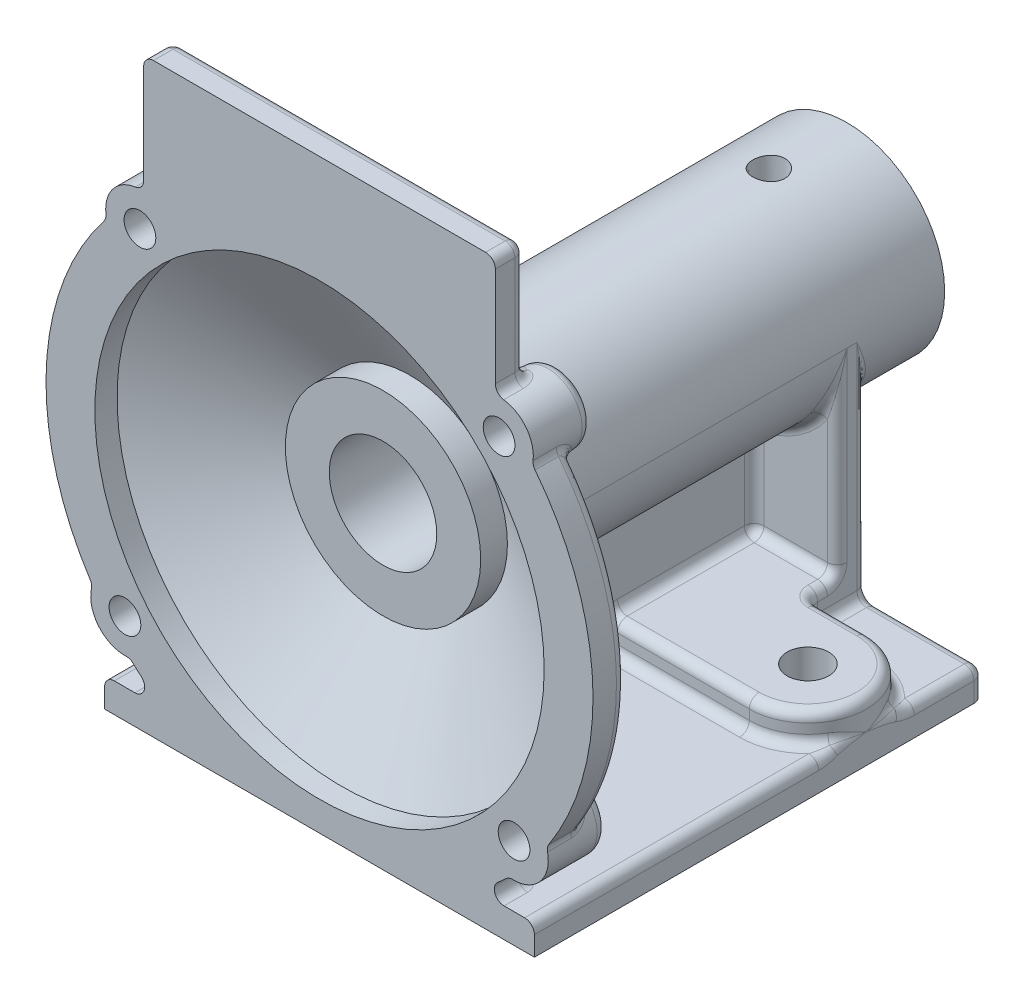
SolidWorks part; units mm, degrees
ref_plane "Front" through (0, 0, 0) normal (0, 0, 1) x (1, 0, 0)
ref_plane "Top" through (0, 0, 0) normal (0, 1, 0) x (1, 0, 0)
ref_plane "Right" through (0, 0, 0) normal (1, 0, 0) x (0, 0, -1)
sketch "Sketch1" plane through (0, 0, 0) normal (1, 0, 0) x (0, 0, -1)
  line L0 (0, 0) -> (89.8884, 0) construction
  line L1 (0, -73.025) -> (0, -88.9)
  line L2 (0, -88.9) -> (9.525, -88.9)
  line L3 (9.525, -88.9) -> (40.1411, -31.75)
  line L4 (40.1411, -31.75) -> (171.45, -31.75)
  line L5 (171.45, -31.75) -> (171.45, -17.4625)
  line L6 (171.45, -17.4625) -> (120.65, -17.4625)
  line L7 (120.65, -17.4625) -> (120.65, -20.6375)
  line L8 (120.65, -20.6375) -> (69.85, -20.6375)
  line L9 (69.85, -20.6375) -> (69.85, -17.4625)
  line L10 (69.85, -17.4625) -> (20.6502, -17.4625)
  line L11 (20.6502, -17.4625) -> (20.6502, -31.75)
  line L12 (20.6502, -31.75) -> (29.3354, -31.75)
  line L13 (29.3354, -31.75) -> (7.2238, -73.025)
  line L14 (7.2238, -73.025) -> (0, -73.025)
  point P5 (57.15, 0)
  dimension "D1" = 34.925
  dimension "D2" = 41.275
  dimension "D3" = 50.8
  dimension "D4" = 50.8
  dimension "D5" = 63.5
  dimension "D6" = 146.05
  dimension "D7" = 177.8
  dimension "D8" = 9.525
  dimension "D9" = 9.525
  dimension "D10" = 20.6502
  dimension "D11" = 171.45
  dimension "D12" = 57.15
revolve "Revolve1" add sketch "Sketch1" angle 360 about L0
sketch "Sketch2" plane through (0, 0, 0) normal (0, 0, 1) x (1, 0, 0)
  line L0 (0, 0) -> (0, 144.1236) construction
  line L1 (-57.15, 68.0962) -> (-26.3735, 68.0962)
  line L2 (-57.15, 68.0962) -> (-57.15, 107.95)
  line L3 (-57.15, 107.95) -> (57.15, 107.95)
  line L4 (57.15, 68.0962) -> (57.15, 107.95)
  line L5 (26.3735, 68.0962) -> (57.15, 68.0962)
  circle A0 centre (0, 0) radius 88.9 construction
  circle A1 centre (0, 0) radius 73.025 construction
  arc A2 (26.3735, 68.0962) -> (-26.3735, 68.0962) centre (0, 0) ccw
  dimension "D1" = 114.3
  dimension "D2" = 107.95
extrude "Extrude1" add sketch "Sketch2" against normal blind 9.525
sketch "Sketch3" plane through (0, 0, 0) normal (0, 0, 1) x (1, 0, 0)
  line L0 (0, 0) -> (105.8426, 0) construction
  line L1 (0, 0) -> (73.9921, 73.9921) construction
  line L2 (49.9927, 65.6904) -> (43.7106, 58.4982)
  line L3 (65.6904, 49.9927) -> (58.4982, 43.7106)
  circle A0 centre (0, 0) radius 82.55 construction
  arc A1 (49.9927, 65.6904) -> (65.6904, 49.9927) centre (58.3717, 58.3717) cw
  circle A2 centre (0, 0) radius 73.025 construction
  circle A3 centre (0, 0) radius 73.025 construction
  arc A4 (58.4982, 43.7106) -> (43.7106, 58.4982) centre (0, 0) ccw
  dimension "D2" = 165.1
  dimension "D3" = 11.1252
  dimension "D1" = 45
extrude "Extrude2" add sketch "Sketch3" against normal blind 19.05
sketch "Sketch4" plane through (0, 0, -19.05) normal (0, 0, -1) x (-1, 0, 0)
  circle A0 centre (-58.3717, 58.3717) radius 5.1562
  dimension "D1" = 10.3124
extrude "Extrude3" cut sketch "Sketch4" against normal through all
pattern_circular "CirPattern1" count 2 every 85 about axis through (0, 0, 0) along (0, 0, 1) of "Extrude2", "Extrude3"
mirror "Mirror1" about plane through (0, 0, 0) normal (1, 0, 0) of "CirPattern1", "Extrude2", "Extrude3"
other "DeleteFace1"
ref_plane "Plane1" through (0, -82.55, 0) normal (0, 1, 0) x (-1, 0, 0)
other "SurfaceCut1"
sketch "Sketch5" plane through (0, -82.55, 0) normal (0, 1, 0) x (-1, 0, 0)
  line L0 (0, -146.05) -> (0, 0) construction
  line L1 (-69.85, 0) -> (69.85, 0)
  line L2 (-69.85, 0) -> (-69.85, -146.05)
  line L3 (-69.85, -146.05) -> (69.85, -146.05)
  line L4 (69.85, 0) -> (69.85, -146.05)
  dimension "D1" = 139.7
  dimension "D2" = 146.05
extrude "Extrude4" add sketch "Sketch5" along normal blind 9.525
sketch "Sketch8" plane through (0, 0, -146.05) normal (0, 0, -1) x (-1, 0, 0)
  line L0 (0, -73.025) -> (0, -31.75)
  line L1 (-69.85, -73.025) -> (69.85, -73.025) construction
  circle A0 centre (0, 0) radius 31.75 construction
rib "Rib2" sketch "Sketch8" sketch "Sketch8" thickness 9.525 extrusion direction normal to sketch draft on no parameters "D1"=9.525
sketch "Sketch9" plane through (0, 0, -146.05) normal (0, 0, -1) x (-1, 0, 0)
  line L0 (-31.75, 0) -> (-31.75, -73.025)
  line L4 (-4.7625, -73.025) -> (-50.7007, -73.025) construction
  line L6 (31.75, 0) -> (31.75, -73.025)
  line L7 (50.7007, -73.025) -> (4.7625, -73.025) construction
  line L8 (-31.75, -73.025) -> (31.75, -73.025)
  arc A4 (4.7625, -31.3908) -> (-4.7625, -31.3908) centre (0, 0) ccw construction
  circle A5 centre (0, 0) radius 31.75 construction
  arc A6 (-31.75, 0) -> (31.75, 0) centre (0, 0) ccw
extrude "Extrude5" add sketch "Sketch9" against normal blind 9.525
sketch "Sketch10" plane through (0, 0, 0) normal (1, 0, 0) x (0, 0, -1)
  line L0 (0, -49.5673) -> (0, -64.1873) construction
  line L1 (0, -82.55) -> (146.05, -82.55) construction
  circle A0 centre (63.5, -53.975) radius 12.7
  dimension "D1" = 25.4
  dimension "D2" = 63.5
  dimension "D3" = 28.575
extrude "Extrude6" cut sketch "Sketch10" against normal through all and the other way through all
sketch "Sketch11" plane through (0, -73.025, 0) normal (0, 1, 0) x (1, 0, 0)
  line L0 (31.75, 146.05) -> (4.7625, 146.05)
  line L1 (31.75, 146.05) -> (-31.75, 146.05) construction
  line L2 (4.7625, 146.05) -> (4.7625, 88.9)
  line L3 (4.7625, 136.525) -> (4.7625, 40.1411) construction
  line L4 (4.7625, 88.9) -> (50.8, 88.9)
  line L5 (50.8, 127) -> (31.75, 127)
  line L6 (31.75, 40.1411) -> (31.75, 136.525) construction
  line L7 (31.75, 127) -> (31.75, 146.05)
  line L8 (69.85, 0) -> (69.85, 146.05) construction
  line L10 (57.15, 0) -> (-57.15, 0) construction
  arc A0 (50.8, 88.9) -> (50.8, 127) centre (50.8, 107.95) ccw
  dimension "D1" = 50.8
  dimension "D2" = 107.95
extrude "Extrude7" add sketch "Sketch11" along normal blind 9.525
sketch "Sketch12" plane through (0, -63.5, 0) normal (0, 1, 0) x (1, 0, 0)
  circle A0 centre (50.8, 107.95) radius 6.7437
  dimension "D1" = 13.4874
extrude "Extrude8" cut sketch "Sketch12" against normal through all
mirror "Mirror2" about plane through (0, 0, 0) normal (1, 0, 0) of "Extrude8", "Extrude7"
ref_plane "Plane2" through (0, 31.75, -105.7955) normal (0, 1, 0) x (-1, 0, 0)
sketch "Sketch13" plane through (0, 31.75, -105.7955) normal (0, 1, 0) x (-1, 0, 0)
  line L0 (0, 44.0417) -> (0, 112.0674) construction
  line L1 (-11.1252, 65.6545) -> (11.1252, 65.6545)
  line L2 (-31.75, 65.6545) -> (31.75, 65.6545) construction
  line L3 (11.1252, 65.6545) -> (11.1252, 61.3455)
  line L4 (-11.1252, 61.3455) -> (-11.1252, 65.6545)
  line L5 (-20.6375, 35.9455) -> (20.6375, 35.9455) construction
  arc A0 (11.1252, 61.3455) -> (-11.1252, 61.3455) centre (0, 61.3455) cw
  dimension "D1" = 11.1252
  dimension "D2" = 25.4
extrude "Extrude9" add sketch "Sketch13" along normal blind 6.35 and the other way up to next
other "DeleteFace2"
hole_wizard "1/8 NPT Tapped Hole1" positions "3DSketch1" profile "Sketch14" size "1/8" standard "Ansi Inch"
sketch3d "3DSketch1"
  arc A0 (11.1252, 38.1, -44.45) -> (-11.1252, 38.1, -44.45) centre (0, 38.1, -44.45) ccw construction
  point P0 (0, 38.1, -44.45)
  point P2 (0, 31.75, -146.05)
  point P9 (0, 49.2252, -44.45)
  dimension "D1" = 25.4
sketch "Sketch14" plane through (0, 38.1, -44.45) normal (1, 0, 0) x (0, 0, 1)
  line L0 (0, 0) -> (0, 20.6375)
  line L1 (0, 20.6375) -> (4.2164, 20.6375)
  line L2 (-4.9362, 9.525) -> (-5.2214, 0) construction
  line L3 (4.2164, 20.6375) -> (4.2164, 9.525)
  line L4 (4.2164, 9.525) -> (4.9362, 9.525)
  line L5 (4.9362, 9.525) -> (5.2214, 0)
  line L7 (5.2214, 0) -> (0, 0)
  line L8 (0, -6.35) -> (0, 107.95) construction
  line L11 (-4.2164, 9.525) -> (-4.9362, 9.525) construction
  dimension "Thru Tap Drill Dia." = 8.4328
  dimension "Thru Tap Drill Depth" = 20.6375
  dimension "Thread Dia." = 10.4428
  dimension "Thread Angle" = 3.43
  dimension "Thread Depth" = 9.525
fillet "Fillet1" radius 3.175 14 edges at (-31.75, -31.75, -136.525) (31.75, -31.75, -136.525) (-31.75, -63.5, -131.7625) (31.75, -63.5, -131.7625) (-27.7812, -63.5, -88.9) (-41.275, -63.5, -127) (27.7812, -63.5, -88.9) (41.275, -63.5, -127) (-18.2562, -63.5, -136.525) (-31.75, -68.2625, -127) (-69.85, -63.5, -107.95) (18.2563, -63.5, -136.525) (31.75, -68.2625, -127) (69.85, -63.5, -107.95)
fillet "Fillet2" radius 3.175 24 edges at (-31.75, -73.025, -138.1125) (-32.6799, -73.025, -127.9299) (-42.8625, -73.025, -127) (-64.2704, -73.025, -121.4204) (-64.2704, -73.025, -94.4796) (-4.7625, -45.8579, -136.525) (-4.7625, -62.5701, -135.5951) (-4.7625, -63.5, -112.7125) (-4.7625, -64.4299, -89.8299) (4.7625, -45.8579, -136.525) (4.7625, -62.5701, -135.5951) (4.7625, -63.5, -112.7125) (4.7625, -64.4299, -89.8299) (31.75, -73.025, -138.1125) (32.6799, -73.025, -127.9299) (42.8625, -73.025, -127) (64.2704, -73.025, -121.4204) (64.2704, -73.025, -94.4796) (-27.7812, -73.025, -88.9) (-4.7625, -69.85, -88.9) (-4.7625, -73.025, -53.4232) (4.7625, -73.025, -53.4232) (4.7625, -69.85, -88.9) (27.7812, -73.025, -88.9)
fillet "Fillet3" radius 3.175 28 edges at (-50.7007, -73.025, -4.7625) (50.7007, -73.025, -4.7625) (31.75, -34.925, -146.05) (32.6799, -72.0951, -146.05) (69.85, -73.025, -48.2512) (69.85, -73.025, -102.2262) (69.85, -73.025, -113.6738) (6.0975, -72.4375, -18.207) (-5.6525, -72.0545, -18.4308) (-31.75, -34.925, -146.05) (-32.6799, -72.0951, -146.05) (-69.85, -73.025, -48.2512) (-69.85, -73.025, -102.2262) (-69.85, -73.025, -113.6738) (69.85, -77.7875, -146.05) (52.3875, -73.025, -146.05) (69.85, -73.025, -132.7238) (56.3432, -68.7652, -9.525) (-56.3432, -68.7652, -9.525) (-69.85, -77.7875, -146.05) (-52.3875, -73.025, -146.05) (-69.85, -73.025, -132.7238) (-4.7625, -41.275, -63.5) (4.7625, -41.275, -63.5)
fillet "Fillet4" radius 3.175 21 edges at (11.1252, 38.1, -40.1685) (-11.1252, 38.1, -40.1685) (-11.1252, 29.7371, -42.2955) (11.1252, 29.7371, -42.2955) (-30.6752, -8.191, -137.3189) (-31.6957, -1.8554, -40.1411) (-5.5714, -31.2574, -41.0895) (-4.7625, -31.3908, -88.3781) (-5.9268, -31.1919, -135.8072) (31.6957, -1.8554, -40.1411) (5.9455, -31.1884, -40.7249) (4.7625, -31.3908, -88.3781) (5.4424, -31.2801, -135.3134) (30.6752, -8.191, -137.3189) (-30.6752, -8.191, -145.2561) (30.6752, -8.191, -145.2561) (0, 38.1, -55.5752) (0.9693, 31.7352, -55.5329) (-20.1175, -24.5632, -136.525) (20.1175, -24.5632, -136.525) (0, -31.75, -146.05)
fillet "Fillet5" radius 3.175 15 edges at (51.3964, -57.1126, -19.05) (65.1698, -40.6981, -19.05) (-51.3964, -57.1126, -19.05) (-65.1698, -40.6981, -19.05) (-61.3748, 46.2232, -19.05) (-46.2232, 61.3748, -19.05) (61.3748, 46.2232, -19.05) (46.2232, 61.3748, -19.05) (71.7594, -60.2133, -19.05) (-71.7594, -60.2133, -19.05) (-66.2384, 66.2384, -19.05) (66.2384, 66.2384, -19.05) (-88.8154, 3.8778, -9.525) (0, 88.9, -9.525) (88.8154, 3.8778, -9.525)
fillet "Fillet6" radius 3.175 48 edges at (-57.15, 69.4296, -4.7625) (57.15, 69.4296, -4.7625) (-61.6293, -64.0705, -3.812) (-61.4023, -64.035, -8.6861) (-57.773, -62.7531, -11.4549) (-49.0287, -52.2246, -18.7754) (-73.799, -49.5673, -3.812) (-73.5874, -48.983, -9.3353) (-60.473, -39.116, -18.5672) (-69.1981, 55.8107, -3.812) (-69.1429, 55.5876, -8.6861) (-67.5496, 52.0839, -11.4549) (-56.299, 44.2904, -18.7754) (-56.9935, 69.4112, -9.525) (-55.2807, 69.0589, -9.7761) (-53.2439, 68.2447, -10.7798) (-44.2377, 56.8337, -18.5672) (69.1981, 55.8107, -3.812) (69.0382, 55.2102, -9.3353) (67.5496, 52.0839, -11.4549) (56.8337, 44.2377, -18.5672) (56.9935, 69.4112, -9.525) (56.5106, 69.3401, -9.5345) (53.2439, 68.2447, -10.7798) (44.2904, 56.299, -18.7754) (61.6293, -64.0705, -3.812) (61.0172, -63.9636, -9.3353) (57.773, -62.7531, -11.4549) (49.0228, -52.7619, -18.5672) (73.799, -49.5673, -3.812) (73.7246, -49.3499, -8.6861) (59.9449, -39.2151, -18.7754) (-57.15, 88.6898, -9.525) (57.15, 88.6898, -9.525) (-54.4811, -45.7151, -19.05) (-50.2894, 50.2894, -19.05) (50.2894, 50.2894, -19.05) (54.4811, -45.7151, -19.05)
fillet "Fillet7" radius 3.175 5 edges at (57.15, 107.95, -3.175) (56.2201, 107.95, -8.5951) (-57.15, 107.95, -3.175) (-56.2201, 107.95, -8.5951) (0, 107.95, -9.525)
fillet "Fillet8" [suppressed] radius 3.175
